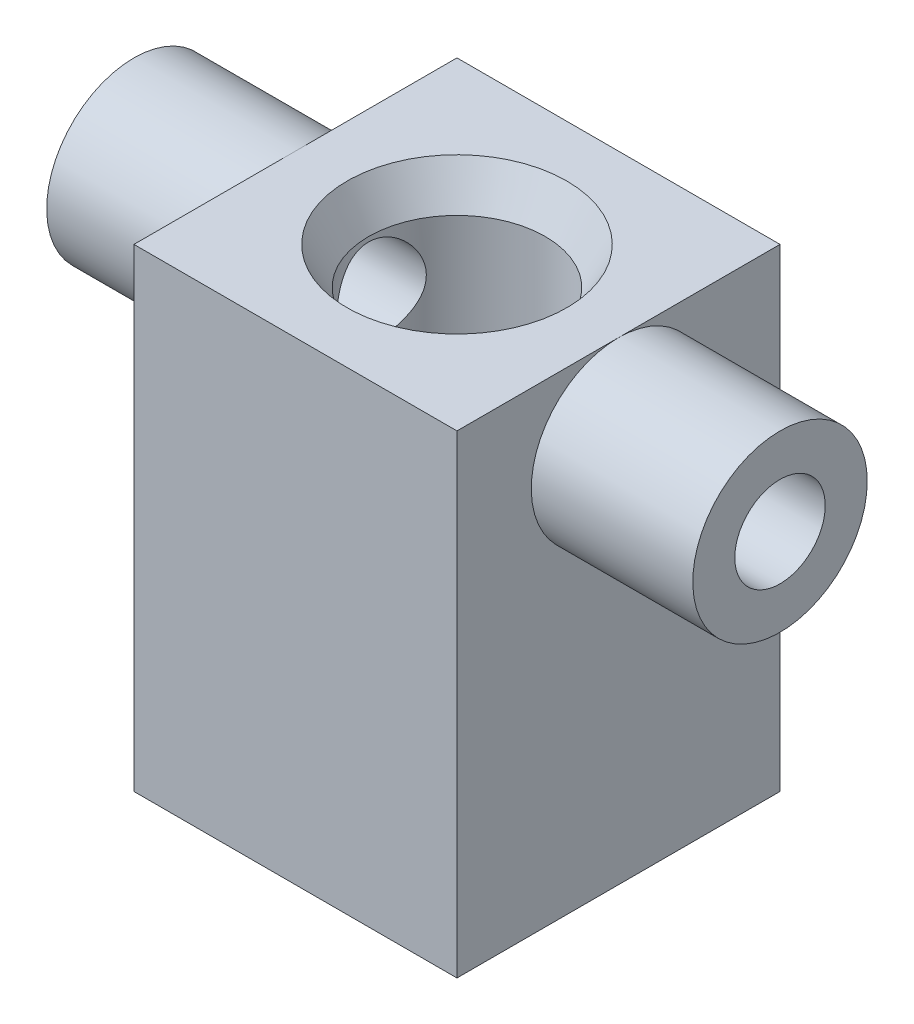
SolidWorks part; units mm, degrees
ref_plane "Front Plane" through (0, 0, 0) normal (0, 0, 1) x (1, 0, 0)
ref_plane "Top Plane" through (0, 0, 0) normal (0, 1, 0) x (1, 0, 0)
ref_plane "Right Plane" through (0, 0, 0) normal (1, 0, 0) x (0, 0, -1)
sketch "Sketch2" plane through (0, 0, 0) normal (0, 0, 1) x (1, 0, 0)
  line L1 (-7.5, -11) -> (7.5, -11)
  line L2 (-7.5, -11) -> (-7.5, 11)
  line L3 (-7.5, 11) -> (7.5, 11)
  line L4 (7.5, -11) -> (7.5, 11)
  line L5 (-7.5, -11) -> (7.5, 11) construction
  line L6 (-7.5, 11) -> (7.5, -11) construction
  point P0 (0, 0)
extrude "Boss-Extrude1" add sketch "Sketch2" along normal mid plane 15
sketch "Sketch3" plane through (0, 0, 0) normal (1, 0, 0) x (0, 0, -1)
  line L0 (-7.5, 11) -> (7.5, 11) construction
  circle A0 centre (0, 6.95) radius 4.05
  dimension "D1" = 4.05
extrude "Boss-Extrude2" add sketch "Sketch3" along normal mid plane 30
sketch "Sketch4" plane through (0, 11, 0) normal (0, 1, 0) x (1, 0, 0)
  circle A0 centre (0, 0) radius 4.1
extrude "Cut-Extrude1" cut sketch "Sketch4" against normal through all
sketch "Sketch5" plane through (-15, 0, 0) normal (-1, 0, 0) x (0, 0, 1)
  circle A0 centre (0, 6.95) radius 2.1
extrude "Cut-Extrude2" cut sketch "Sketch5" against normal through all
chamfer "Chamfer1" distance 1 angle 60 2 edges at (0, -11, 4.1) (0, 11, 4.1)
